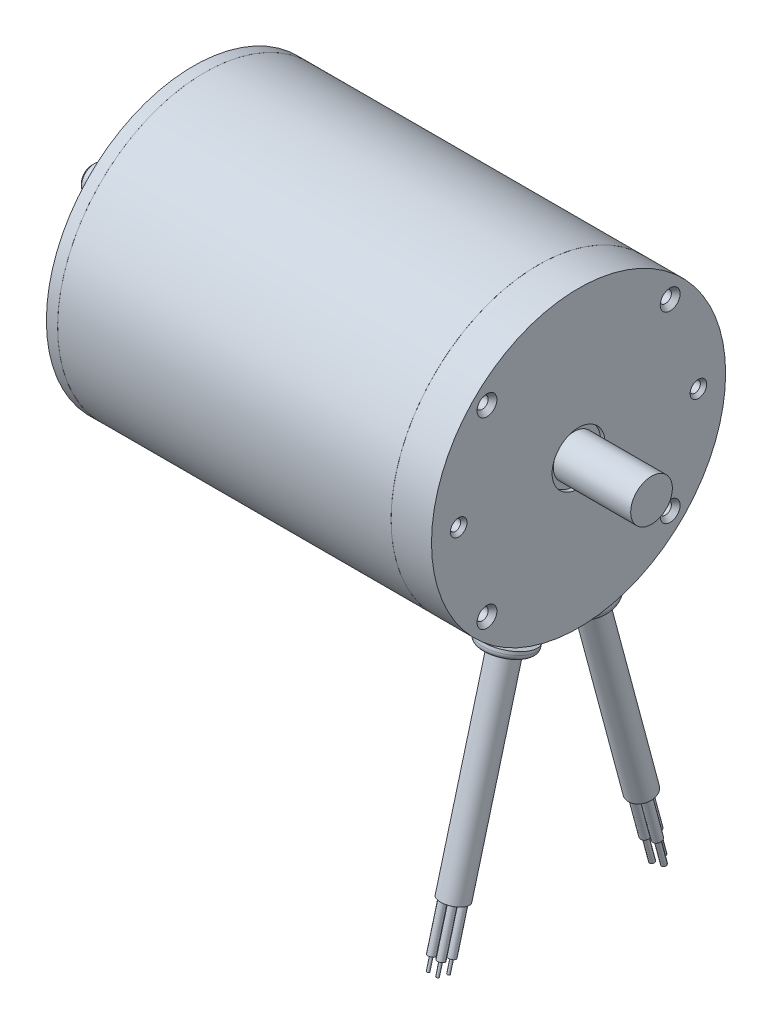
SolidWorks part; units mm, degrees
ref_plane "Front Plane" through (0, 0, 0) normal (0, 0, 1) x (1, 0, 0)
ref_plane "Top Plane" through (0, 0, 0) normal (0, 1, 0) x (1, 0, 0)
ref_plane "Right Plane" through (0, 0, 0) normal (1, 0, 0) x (0, 0, -1)
sketch "Sketch1" plane through (0, 0, 0) normal (0, 0, 1) x (1, 0, 0)
  line L0 (0, 0) -> (138.9109, 0) construction
  line L1 (0, 0) -> (0, 2.5)
  line L2 (0, 2.5) -> (21.12, 2.5)
  line L3 (21.12, 2.5) -> (21.12, 11.006)
  line L4 (21.12, 11.006) -> (20.92, 11.006)
  line L5 (20.92, 11.006) -> (20.92, 9.4)
  line L6 (20.92, 9.4) -> (17.5, 9.4)
  line L7 (17.5, 9.4) -> (17.5, 12.5)
  line L8 (17.5, 12.5) -> (19.5, 12.5)
  line L9 (19.5, 12.5) -> (19.5, 28.22)
  line L10 (19.5, 28.22) -> (93.4, 28.22)
  line L11 (93.4, 28.22) -> (93.4, 5.08)
  line L12 (93.4, 5.08) -> (92.56, 5.08)
  line L13 (92.56, 5.08) -> (92.56, 4)
  line L14 (107.4, 0) -> (0, 0)
  line L15 (92.56, 4) -> (107.4, 4)
  line L16 (107.4, 4) -> (107.4, 0)
  dimension "D2" = 25
  dimension "D3" = 18.8
  dimension "D4" = 2
  dimension "D5" = 22.012
  dimension "D6" = 5
  dimension "D7" = 21.12
  dimension "D8" = 56.44
  dimension "D9" = 19.5
  dimension "D11" = 0.2
  dimension "LENGTH" = 73.9
  dimension "D12" = 8
  dimension "D13" = 14
  dimension "D14" = 10.16
  dimension "D15" = 14.84
revolve "Revolve1" add sketch "Sketch1" angle 360 about L0
chamfer "Chamfer1" distance 0.508 angle 45 1 edges at (0, 0, 2.5)
fillet "Fillet1" radius 0.25 1 edges at (17.5, 0, 12.5)
fillet "Fillet2" radius 0.13 1 edges at (17.5, 0, 9.4)
sketch "Sketch2" plane through (0, 0, 0) normal (0, 0, 1) x (1, 0, 0)
  line L0 (93.4, 28.22) -> (19.5, 28.22) construction
  line L2 (85.6465, 28.22) -> (85.6535, 28.22)
  line L3 (19.5, 28.22) -> (19.5, -28.22) construction
  line L4 (21.6638, 28.22) -> (21.66, 28.2138)
  line L5 (21.66, 28.2138) -> (21.6568, 28.22)
  line L6 (85.6535, 28.22) -> (85.65, 28.2139)
  line L7 (85.65, 28.2139) -> (85.6465, 28.22)
  line L8 (21.6638, 28.22) -> (21.6568, 28.22)
  line L9 (93.4, -28.22) -> (93.4, 28.22) construction
  dimension "D1" = 0.007
  dimension "D2" = 2.16
  dimension "D3" = 28.2138
  dimension "D4" = 0.007
  dimension "D5" = 7.75
revolve "Cut-Revolve1" cut sketch "Sketch2" angle 360 about axis through (0, 0, 0) along (-1, 0, 0)
sketch "Sketch25" plane through (0, 0, 0) normal (0, 0, 1) x (1, 0, 0)
  line L0 (21.12, 11.006) -> (21.12, -11.006) construction
  line L1 (21.12, 6.5772) -> (21.12, 5.8868)
  line L2 (20.92, 9.3646) -> (21.4467, 9.3646)
  line L3 (20.92, -11.006) -> (20.92, 11.006) construction
  line L4 (21.4467, 9.3646) -> (21.4467, 6.904)
  line L5 (21.4467, 6.904) -> (21.12, 6.5772)
  line L6 (21.12, 5.8868) -> (21.4467, 5.56)
  line L7 (21.4467, 5.56) -> (21.4467, 2.7378)
  line L8 (20.92, 2.5) -> (22.9293, 2.5) construction
  line L9 (21.12, 2.5) -> (0.508, 2.5) construction
  line L10 (21.4467, 2.7378) -> (22.7362, 2.7378)
  line L11 (22.7362, 2.7378) -> (22.7362, 2.5)
  line L12 (22.7362, 2.5) -> (20.92, 2.5)
  line L13 (20.92, 2.5) -> (20.92, 9.3646)
  dimension "D1" = 2.7378
  dimension "D2" = 6.8646
  dimension "D3" = 0.5267
  dimension "D4" = 1.2895
  dimension "D5" = 3.149
  dimension "D6" = 45
  dimension "D7" = 2.7874
  dimension "D8" = 45
revolve "Cut-Revolve2" cut sketch "Sketch25" angle 360 about axis through (0, 0, 0) along (-1, 0, 0)
sketch "Sketch10" plane through (93.4, 0, 0) normal (1, 0, 0) x (0, 0, -1)
  line L0 (0, 0) -> (-23, 0) construction
  line L1 (0, 0) -> (-17.5751, 17.5751) construction
  circle A0 centre (0, 0) radius 24.855 construction
  circle A1 centre (0, 0) radius 23 construction
  dimension "D1" = 49.71
  dimension "D2" = 46
  dimension "D3" = 45
hole_wizard "#4-40 Tapped Hole2" positions "Sketch12" profile "Sketch11" tap size "#4-40" standard "Ansi Inch"
sketch "Sketch12" plane through (93.4, 0, 0) normal (1, 0, 0) x (0, 0, -1)
  point P0 (-17.5751, 17.5751)
sketch "Sketch11" plane through (93.4, 17.5751, 17.5751) normal (0, 1, 0) x (0, 0, -1)
  line L0 (0, 0) -> (0, 8.2742)
  line L1 (0, 8.2742) -> (1.1303, 7.595)
  line L2 (1.1303, 7.595) -> (1.1303, 0.8912)
  line L3 (1.1303, 0.8912) -> (1.905, 0)
  line L5 (1.905, 0) -> (0, 0)
  line L6 (-1.1303, 0.8912) -> (-1.905, 0) construction
  line L10 (0, 8.2742) -> (-1.1303, 7.595) construction
  line L11 (0, -6.35) -> (0, 107.95) construction
  dimension "Tap Drill Dia." = 2.2606
  dimension "Tap Drill Depth" = 7.595
  dimension "Near C'Sink Dia." = 3.81
  dimension "Near C'Sink Angle" = 82
  dimension "Drill Angle" = 118
hole_wizard "M2.5x0.45 Tapped Hole2" positions "Sketch16" profile "Sketch15" tap size "M2.5x0.45" standard "Ansi Metric"
sketch "Sketch16" plane through (93.4, 0, 0) normal (1, 0, 0) x (0, 0, -1)
  point P0 (-23, 0)
sketch "Sketch15" plane through (93.4, 0, 23) normal (0, 1, 0) x (0, 0, -1)
  line L0 (0, 0) -> (0, 6.9659)
  line L1 (0, 6.9659) -> (1.025, 6.35)
  line L2 (1.025, 6.35) -> (1.025, 0.65)
  line L3 (1.025, 0.65) -> (1.59, 0)
  line L5 (1.59, 0) -> (0, 0)
  line L6 (-1.025, 0.65) -> (-1.59, 0) construction
  line L10 (0, 6.9659) -> (-1.025, 6.35) construction
  line L11 (0, -6.35) -> (0, 107.95) construction
  dimension "Tap Drill Dia." = 2.05
  dimension "Tap Drill Depth" = 6.35
  dimension "Near C'Sink Dia." = 3.18
  dimension "Near C'Sink Angle" = 82
  dimension "Drill Angle" = 118
pattern_circular "CirPattern2" count 2 over 360 about axis through (0, 0, 0) along (1, 0, 0) of "M2.5x0.45 Tapped Hole2"
pattern_circular "CirPattern3" count 4 over 360 about axis through (0, 0, 0) along (1, 0, 0) of "#4-40 Tapped Hole2"
sketch "Sketch17" plane through (19.5, 0, 0) normal (-1, 0, 0) x (0, 0, 1)
  line L0 (0, 0) -> (0, 24.855) construction
  line L1 (0, 0) -> (17.5751, 17.5751) construction
  circle A0 centre (0, 0) radius 24.855 construction
  circle A1 centre (0, 0) radius 21 construction
  circle A2 centre (17.5751, 17.5751) radius 1.875
  dimension "D1" = 49.71
  dimension "D2" = 42
  dimension "D4" = 3.75
  dimension "D3" = 45
hole_wizard "M4x0.7 Tapped Hole1" positions "Sketch19" profile "Sketch18" tap size "M4x0.7" standard "Ansi Metric"
sketch "Sketch19" plane through (19.5, 0, 0) normal (-1, 0, 0) x (0, 0, 1)
  line L0 (0, 0) -> (0, 24.855) construction
  circle A0 centre (0, 0) radius 21 construction
  point P0 (0, 21)
sketch "Sketch18" plane through (19.5, 21, 0) normal (0, 1, 0) x (0, 0, 1)
  line L0 (0, 0) -> (0, 11.0914)
  line L1 (0, 11.0914) -> (1.65, 10.1)
  line L2 (1.65, 10.1) -> (1.65, 0.4314)
  line L3 (1.65, 0.4314) -> (2.025, 0)
  line L5 (2.025, 0) -> (0, 0)
  line L6 (-1.65, 0.4314) -> (-2.025, 0) construction
  line L10 (0, 11.0914) -> (-1.65, 10.1) construction
  line L11 (0, -6.35) -> (0, 107.95) construction
  dimension "Tap Drill Dia." = 3.3
  dimension "Tap Drill Depth" = 10.1
  dimension "Near C'Sink Dia." = 4.05
  dimension "Near C'Sink Angle" = 82
  dimension "Drill Angle" = 118
pattern_circular "CirPattern4" count 4 over 360 about axis through (0, 0, 0) along (1, 0, 0) of "M4x0.7 Tapped Hole1"
sketch "Sketch22" plane through (19.5, 0, 0) normal (-1, 0, 0) x (0, 0, 1)
  line L0 (0, 0) -> (0, 24.855) construction
  line L1 (0, 0) -> (17.5751, 17.5751) construction
  circle A0 centre (0, 0) radius 24.855 construction
  circle A1 centre (17.5751, 17.5751) radius 3.175
  dimension "D1" = 49.71
  dimension "D3" = 6.35
  dimension "D2" = 45
extrude "Cut-Extrude2" cut sketch "Sketch22" against normal blind 0.75
sketch "Sketch23" plane through (20.25, 0, 0) normal (-1, 0, 0) x (0, 0, 1)
  line L0 (17.5751, 17.5751) -> (15.3301, 19.8202) construction
  line L1 (17.5751, 17.5751) -> (17.5751, 20.7501) construction
  line L2 (17.5751, 17.5751) -> (19.8202, 19.8202) construction
  line L3 (17.5751, 17.5751) -> (20.7501, 17.5751) construction
  line L4 (17.5751, 17.5751) -> (14.4001, 17.5751) construction
  line L5 (17.5751, 17.5751) -> (15.3301, 15.3301) construction
  line L6 (17.5751, 17.5751) -> (17.5751, 14.4001) construction
  line L7 (17.5751, 17.5751) -> (19.8202, 15.3301) construction
  line L8 (17.0642, 18.6517) -> (16.6054, 19.1106)
  line L9 (18.6517, 18.086) -> (19.1106, 18.5449)
  line L10 (18.086, 16.4985) -> (18.5449, 16.0397)
  line L11 (16.4985, 17.0642) -> (16.0397, 16.6054)
  line L12 (16.4985, 18.086) -> (16.0397, 18.5449)
  line L13 (18.086, 18.6517) -> (18.5449, 19.1106)
  line L14 (18.6517, 17.0642) -> (19.1106, 16.6054)
  line L15 (17.0642, 16.4985) -> (16.6054, 16.0397)
  line L16 (17.5751, 15.9876) -> (17.444, 16.6982)
  line L17 (17.858, 17.858) -> (15.6129, 20.103) construction
  line L18 (17.2923, 17.2923) -> (15.0472, 19.5374) construction
  line L19 (17.2923, 17.858) -> (15.0472, 15.6129) construction
  line L20 (17.858, 17.2923) -> (15.6129, 15.0472) construction
  line L21 (17.2923, 17.2923) -> (19.5374, 15.0472) construction
  line L22 (17.858, 17.858) -> (20.103, 15.6129) construction
  line L23 (17.858, 17.2923) -> (20.103, 19.5374) construction
  line L24 (17.2923, 17.858) -> (19.5374, 20.103) construction
  line L25 (17.5751, 15.9876) -> (17.7063, 16.6982)
  line L26 (15.9876, 17.5751) -> (16.6992, 17.7006)
  line L27 (17.5751, 19.1626) -> (17.444, 18.4521)
  line L28 (17.5751, 19.1626) -> (17.7063, 18.4521)
  line L29 (15.9876, 17.5751) -> (16.6992, 17.4497)
  line L30 (19.1626, 17.5751) -> (18.4511, 17.7006)
  line L31 (19.1626, 17.5751) -> (18.4511, 17.4497)
  circle A0 centre (17.5751, 17.5751) radius 3.175 construction
  circle A1 centre (17.5751, 17.5751) radius 3.175 construction
  arc A2 (16.6054, 19.1106) -> (16.0397, 18.5449) centre (17.5751, 17.5751) ccw
  arc A3 (16.0397, 16.6054) -> (16.6054, 16.0397) centre (17.5751, 17.5751) ccw
  arc A4 (18.5449, 16.0397) -> (19.1106, 16.6054) centre (17.5751, 17.5751) ccw
  arc A5 (19.1106, 18.5449) -> (18.5449, 19.1106) centre (17.5751, 17.5751) ccw
  arc A6 (18.086, 16.4985) -> (17.7063, 16.6982) centre (17.5751, 15.9876) ccw
  arc A7 (16.4985, 17.0642) -> (16.6992, 17.4497) centre (15.9876, 17.5751) ccw
  arc A8 (17.0642, 18.6517) -> (17.444, 18.4521) centre (17.5751, 19.1626) ccw
  arc A9 (18.6517, 18.086) -> (18.4511, 17.7006) centre (19.1626, 17.5751) ccw
  arc A10 (17.7063, 18.4521) -> (18.086, 18.6517) centre (17.5751, 19.1626) ccw
  arc A11 (18.4511, 17.4497) -> (18.6517, 17.0642) centre (19.1626, 17.5751) ccw
  arc A12 (17.444, 16.6982) -> (17.0642, 16.4985) centre (17.5751, 15.9876) ccw
  arc A13 (16.6992, 17.7006) -> (16.4985, 18.086) centre (15.9876, 17.5751) ccw
  dimension "D5" = 3.632
  dimension "D1" = 10
  dimension "D2" = 10
  dimension "D3" = 10.457
  dimension "D4" = 10.457
  dimension "D6" = 10
  dimension "D7" = 10.457
  dimension "D8" = 45
  dimension "D9" = 0.4
extrude "Cut-Extrude3" cut sketch "Sketch23" against normal blind 1.75
pattern_circular "CirPattern1" count 4 over 360 about axis through (0, 0, 0) along (1, 0, 0) of "Cut-Extrude3", "Cut-Extrude2"
sketch "Sketch26" plane through (0, 0, 0) normal (0, 1, 0) x (1, 0, 0)
  line L0 (21.4467, 2.7378) -> (21.12, 3.0645)
  line L1 (21.12, 11.006) -> (21.12, -11.006) construction
  line L2 (21.12, 3.0645) -> (21.12, 3.592)
  line L3 (21.12, 3.592) -> (21.4467, 3.9187)
  line L4 (21.4467, 9.3646) -> (21.4467, -9.3646) construction
  line L5 (21.4467, 3.9187) -> (21.4467, 2.7378)
  dimension "D1" = 45
  dimension "D2" = 1.1809
  dimension "D3" = 45
revolve "Revolve2" add sketch "Sketch26" angle 360 about axis through (0, 0, 0) along (-1, 0, 0)
ref_plane "Plane3" through (0, -27.2584, -7.3039) normal (0, -0.9659, -0.2588) x (1, 0, 0)
ref_plane "Plane4" through (0, -27.2584, 7.3039) normal (0, -0.9659, 0.2588) x (1, 0, 0)
sketch "Sketch28" plane through (0, -27.2584, 7.3039) normal (0, -0.9659, 0.2588) x (1, 0, 0)
  line L0 (107.4, 0) -> (0, 0) construction
  line L1 (107.4, -4) -> (107.4, 4) construction
  line L2 (87.4126, 28.22) -> (87.4126, -28.22) construction
  line L3 (93.4, 28.22) -> (85.6535, 28.22) construction
  line L4 (85.6535, -28.22) -> (93.4, -28.22) construction
  line L5 (93.4, -28.22) -> (93.4, 28.22) construction
  circle A0 centre (87.4126, 0) radius 3.175
  dimension "D2" = 6.35
  dimension "D1" = 5.9874
extrude "Boss-Extrude3" add sketch "Sketch28" along normal mid plane 3
sketch "Sketch29" plane through (0, -28.7073, 7.6921) normal (0, -0.9659, 0.2588) x (1, 0, 0)
  circle A0 centre (87.4126, 0) radius 4.7625
  dimension "D1" = 9.525
extrude "Boss-Extrude4" add sketch "Sketch29" along normal blind 1.588
sketch "Sketch30" plane through (0, -30.2412, 8.1031) normal (0, -0.9659, 0.2588) x (1, 0, 0)
  circle A0 centre (87.4126, 0) radius 2.54
  dimension "D1" = 5.08
extrude "Boss-Extrude5" add sketch "Sketch30" along normal blind 38.291
fillet "Fillet4" radius 1 1 edges at (87.4126, -31.4738, 3.5029)
sketch "Sketch31" plane through (0, -67.2275, 18.0135) normal (0, -0.9659, 0.2588) x (1, 0, 0)
  circle A0 centre (87.4126, 0) radius 2.15
  dimension "D1" = 4.3
extrude "Cut-Extrude4" cut sketch "Sketch31" against normal blind 38.291
pattern_circular "CirPattern7" count 2 over 330 about axis through (0, 0, 0) along (-1, 0, 0) of "Cut-Extrude4", "Fillet4", "Boss-Extrude5", "Boss-Extrude4", "Boss-Extrude3"
sketch "Sketch32" plane through (0, -30.2412, -8.1031) normal (0, -0.9659, -0.2588) x (1, 0, 0)
  line L1 (87.4126, 0) -> (87.4126, 6.0964) construction
  line L2 (87.1058, -1.027) -> (87.4126, 0) construction
  line L3 (87.4126, 0) -> (86.6765, 0.7792) construction
  line L4 (87.4126, 0) -> (88.4554, 0.2478) construction
  circle A0 centre (86.6765, 0.7792) radius 0.889
  circle A1 centre (87.1058, -1.027) radius 0.889
  circle A2 centre (88.4554, 0.2478) radius 0.889
  circle A3 centre (87.4126, 0) radius 1.0719 construction
  circle A6 centre (87.4126, 0) radius 2.15 construction
  dimension "D1" = 2.1438
  dimension "D5" = 1.778
  dimension "D2" = 43.369
  dimension "D3" = 120
  dimension "D4" = 120
extrude "Boss-Extrude6" add sketch "Sketch32" along normal blind 47
sketch "Sketch33" plane through (0, -30.2412, 8.1031) normal (0, -0.9659, 0.2588) x (1, 0, 0)
  circle A0 centre (87.4126, 0) radius 0.6985
  circle A1 centre (86.5042, 1.092) radius 0.6985
  circle A2 centre (88.3158, 1.092) radius 0.6985
  circle A3 centre (88.3158, -1.0887) radius 0.6985
  circle A4 centre (86.5042, -1.0887) radius 0.6985
  dimension "D1" = 1.397
  dimension "D2" = 1.0887
  dimension "D3" = 0.9083
  dimension "D4" = 0.9032
  dimension "D5" = 1.0887
  dimension "D6" = 0.9083
  dimension "D7" = 1.092
  dimension "D8" = 0.9032
  dimension "D9" = 1.092
extrude "Boss-Extrude7" add sketch "Sketch33" along normal blind 47
sketch "Sketch34" plane through (0, -75.6397, -20.2676) normal (0, -0.9659, -0.2588) x (1, 0, 0)
  circle A0 centre (88.4554, 0.2478) radius 0.4825
  circle A1 centre (86.6765, 0.7792) radius 0.4825
  circle A2 centre (87.1058, -1.027) radius 0.4825
  dimension "D1" = 0.965
extrude "Boss-Extrude8" add sketch "Sketch34" along normal blind 5.08
sketch "Sketch35" plane through (0, -75.6397, 20.2676) normal (0, -0.9659, 0.2588) x (1, 0, 0)
  circle A0 centre (88.3158, -1.0887) radius 0.254
  circle A1 centre (86.5042, -1.0887) radius 0.254
  circle A2 centre (87.4126, 0) radius 0.254
  circle A3 centre (86.5042, 1.092) radius 0.254
  circle A4 centre (88.3158, 1.092) radius 0.254
  dimension "D1" = 0.508
extrude "Boss-Extrude9" add sketch "Sketch35" along normal blind 2.54
